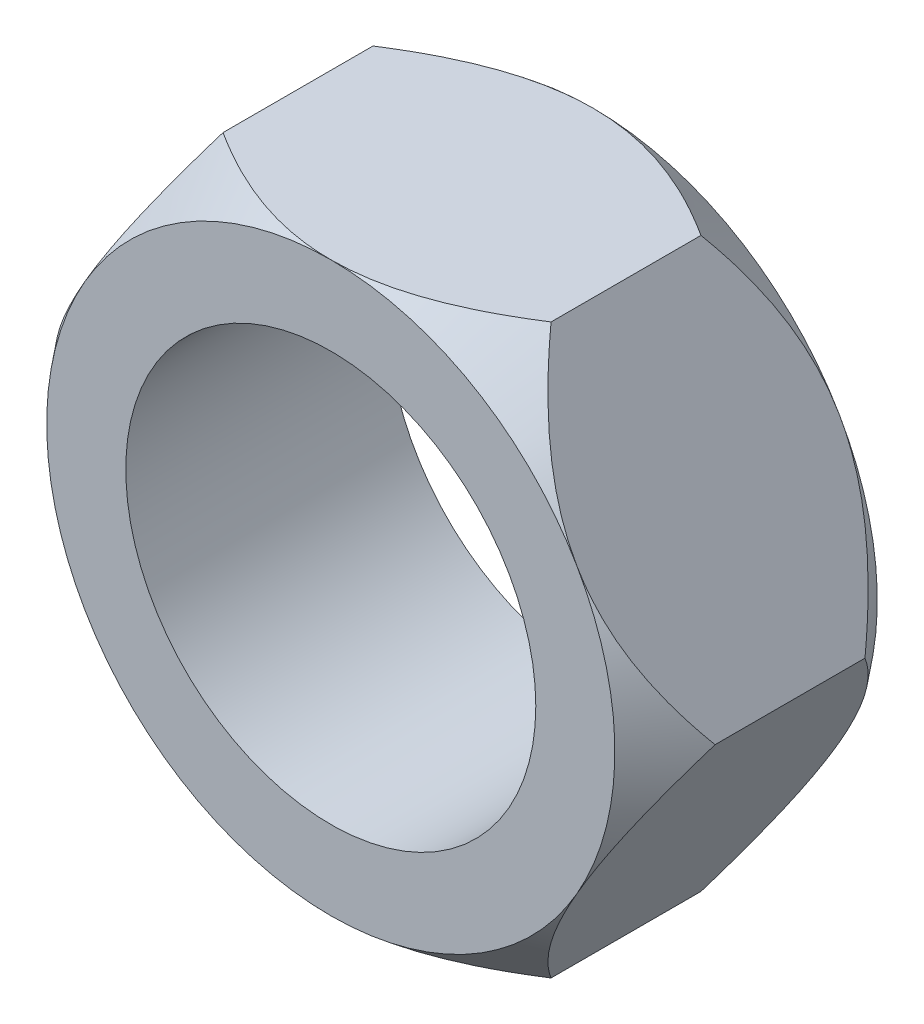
SolidWorks part; units mm, degrees
ref_plane "Front Plane" through (0, 0, 0) normal (0, 0, 1) x (1, 0, 0)
ref_plane "Top Plane" through (0, 0, 0) normal (0, 1, 0) x (1, 0, 0)
ref_plane "Right Plane" through (0, 0, 0) normal (1, 0, 0) x (0, 0, -1)
sketch "Sketch1" plane through (0, 0, 0) normal (0, 0, 1) x (1, 0, 0)
  line L1 (2.54, 4.3994) -> (-2.54, 4.3994)
  line L2 (-2.54, 4.3994) -> (-5.08, 0)
  line L3 (-5.08, 0) -> (-2.54, -4.3994)
  line L4 (-2.54, -4.3994) -> (2.54, -4.3994)
  line L5 (2.54, -4.3994) -> (5.08, 0)
  line L6 (5.08, 0) -> (2.54, 4.3994)
  circle A0 centre (0, 0) radius 4.3994 construction
  circle A1 centre (0, 0) radius 3.175
  dimension "D2" = 6.35
  dimension "D1" = 5.08
extrude "Boss-Extrude1" add sketch "Sketch1" along normal mid plane 4.064
sketch "Sketch2" plane through (0, 0, 2.032) normal (0, 0, 1) x (1, 0, 0)
  circle A0 centre (0, 0) radius 4.3994
  dimension "D1" = 8.7988
extrude "Cut-Extrude1" cut sketch "Sketch2" against normal blind 5.08 draft 38 flip side to cut
mirror "Mirror1" about plane through (0, 0, 0) normal (0, 0, 1) of "Cut-Extrude1"
